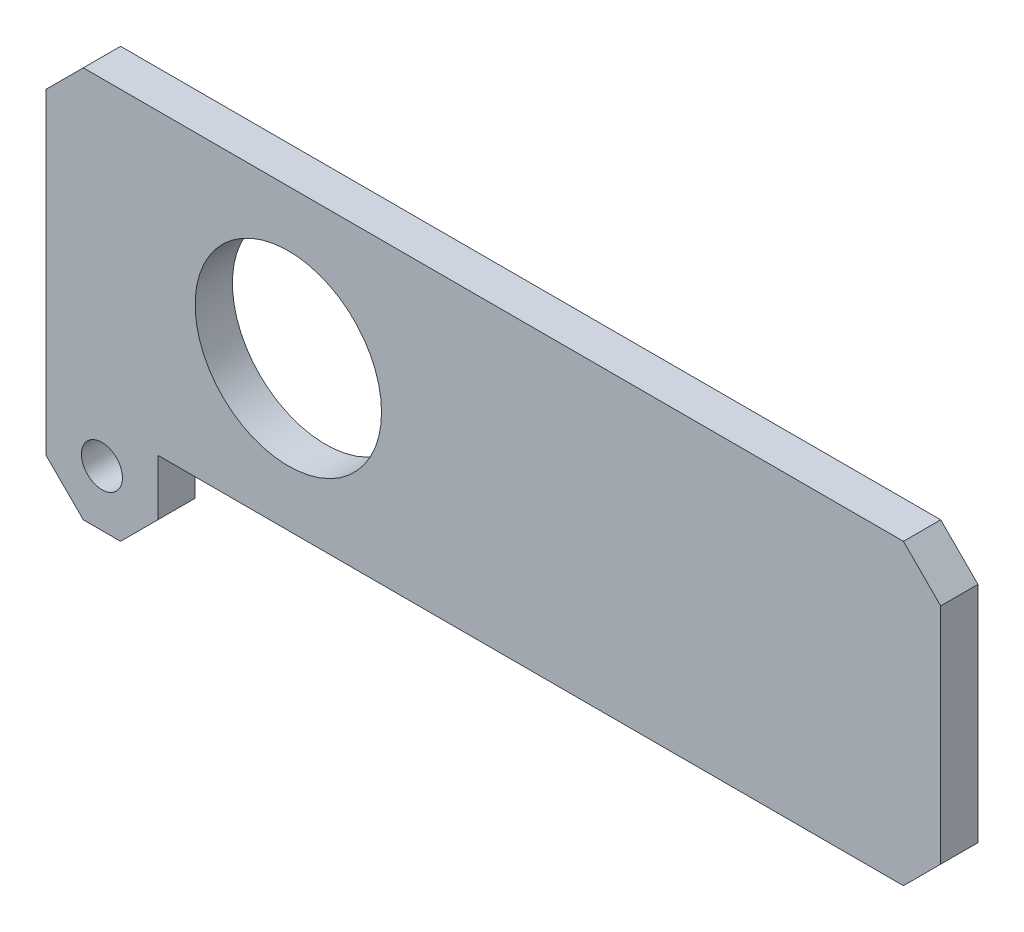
SolidWorks part; units mm, degrees
ref_plane "Plan de face" through (0, 0, 0) normal (0, 0, 1) x (1, 0, 0)
ref_plane "Plan de dessus" through (0, 0, 0) normal (0, 1, 0) x (1, 0, 0)
ref_plane "Plan de droite" through (0, 0, 0) normal (1, 0, 0) x (0, 0, -1)
sketch "Esquisse1" plane through (0, 0, 0) normal (0, 0, 1) x (1, 0, 0)
  line L0 (0, 0) -> (0, 105)
  line L1 (0, 105) -> (240, 105)
  line L2 (240, 105) -> (240, 25)
  line L3 (240, 25) -> (30, 25)
  line L4 (30, 25) -> (30, 0)
  line L5 (30, 0) -> (0, 0)
  line L6 (30, 25) -> (0, 25) construction
  circle A0 centre (65, 65) radius 25
  circle A1 centre (15, 15) radius 5.5
  dimension "D5" = 175
  dimension "D6" = 40
  dimension "D7" = 15
  dimension "D8" = 50
  dimension "D9" = 50
  dimension "D10" = 11
  dimension "D4" = 15
  dimension "D11" = 15
  dimension "D2" = 50
  dimension "D3" = 80
extrude "Extrusion1" add sketch "Esquisse1" along normal blind 10
chamfer "Chanfrein1" distance 10 angle 45 1 edges at (0, 0, 5)
chamfer "Chanfrein2" distance 10 angle 45 1 edges at (30, 0, 5)
chamfer "Chanfrein3" distance 10 angle 45 1 edges at (0, 105, 5)
chamfer "Chanfrein4" distance 10 angle 45 1 edges at (240, 105, 5)
chamfer "Chanfrein5" distance 10 angle 45 1 edges at (240, 25, 5)
ref_plane "Plan1" through (0, 0, 5) normal (0, 0, -1) x (-1, 0, 0)
